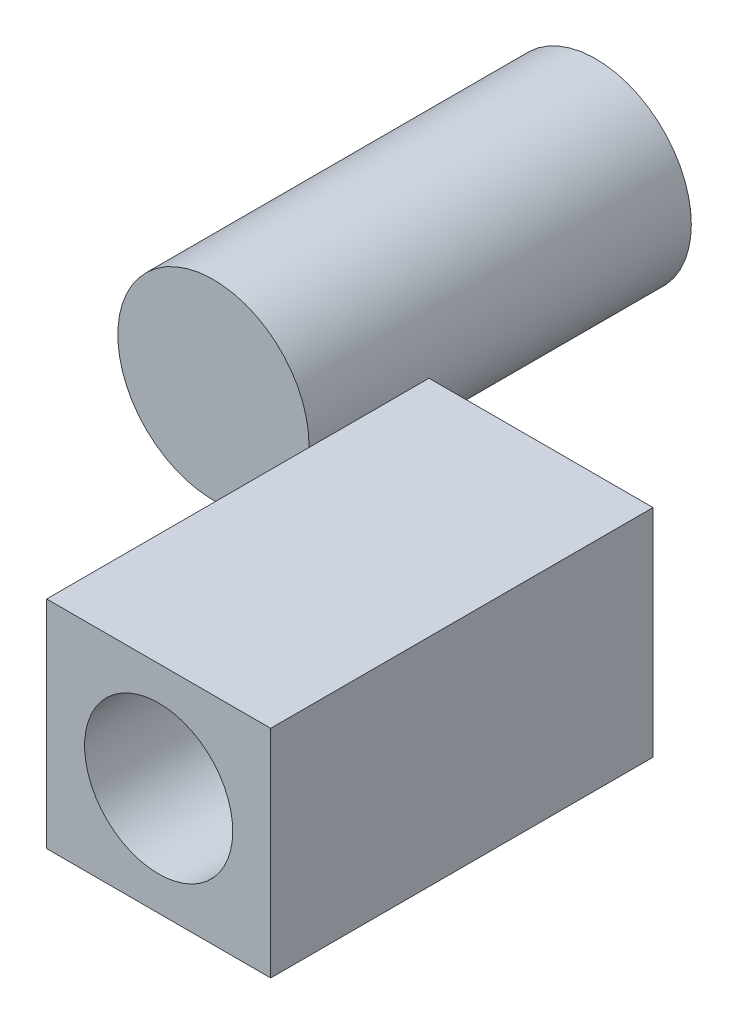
SolidWorks part; units mm, degrees
ref_plane "Plan de face" through (0, 0, 0) normal (0, 0, 1) x (1, 0, 0)
ref_plane "Plan de dessus" through (0, 0, 0) normal (0, 1, 0) x (1, 0, 0)
ref_plane "Plan de droite" through (0, 0, 0) normal (1, 0, 0) x (0, 0, -1)
sketch "Esquisse1" plane through (0, 0, 0) normal (0, 0, 1) x (1, 0, 0)
  circle A0 centre (0, 0) radius 25
extrude "Boss.-Extru.1" add sketch "Esquisse1" along normal blind 100
sketch "Esquisse2" plane through (0, 0, 100) normal (0, 0, 1) x (1, 0, 0)
  line L1 (56.3871, -25.7205) -> (114.9789, -25.7205)
  line L2 (56.3871, -25.7205) -> (56.3871, 30.8408)
  line L3 (56.3871, 30.8408) -> (114.9789, 30.8408)
  line L4 (114.9789, -25.7205) -> (114.9789, 30.8408)
  circle A0 centre (85.683, 2.5602) radius 19.3759
extrude "Boss.-Extru.2" add sketch "Esquisse2" along normal blind 100 separate body
